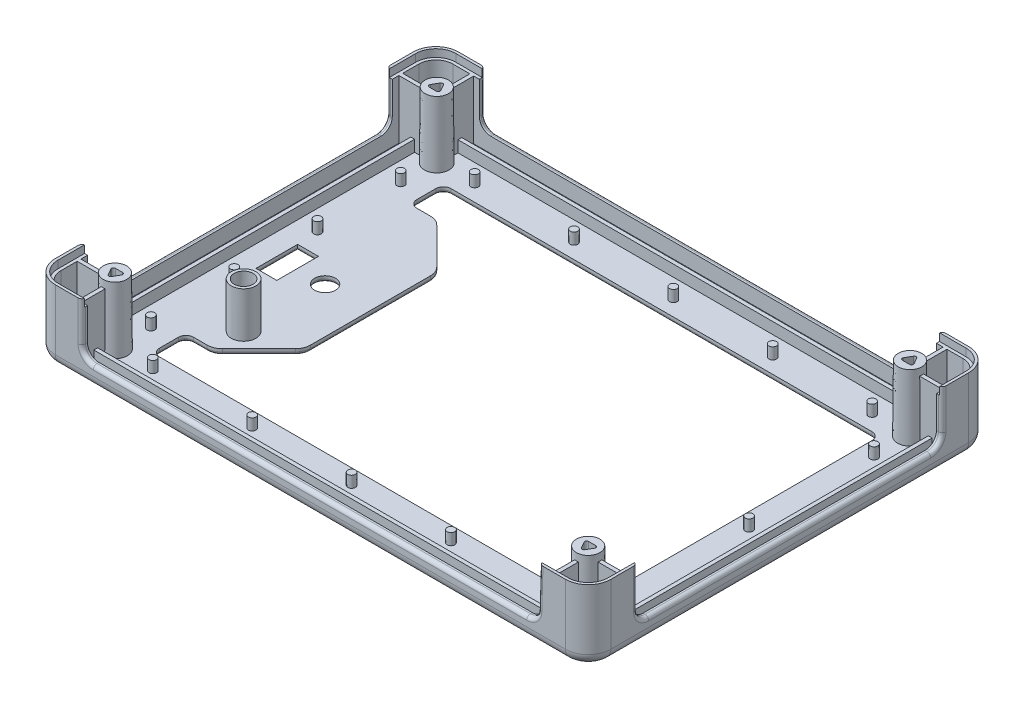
SolidWorks part; units mm, degrees
ref_plane "Plan de face" through (0, 0, 0) normal (0, 0, 1) x (1, 0, 0)
ref_plane "Plan de dessus" through (0, 0, 0) normal (0, 1, 0) x (1, 0, 0)
ref_plane "Plan de droite" through (0, 0, 0) normal (1, 0, 0) x (0, 0, -1)
sketch "Esquisse1" plane through (0, 0, 0) normal (0, 1, 0) x (1, 0, 0)
  line L0 (93.2862, 47.5) -> (62.0832, 47.5) construction
  line L1 (67.5, 66.4163) -> (67.5, 36.9349) construction
  line L2 (-21.7752, -3.5) -> (163.2239, -3.5) construction
  line L3 (0, 0) -> (135, 0) construction
  line L4 (0, 0) -> (0, 95) construction
  line L5 (0, 95) -> (135, 95) construction
  line L6 (135, 0) -> (135, 95) construction
  line L7 (-21.7752, 98.5) -> (163.2239, 98.5) construction
  line L8 (138.5, -9.5468) -> (138.5, 120.2146) construction
  line L10 (-3.75, -9.5468) -> (-3.75, 120.2146) construction
  line L12 (-21.7752, -5.75) -> (163.2239, -5.75) construction
  line L13 (140.75, -9.5468) -> (140.75, 120.2146) construction
  line L16 (-21.7752, 100.75) -> (163.2239, 100.75) construction
  line L17 (-6, -9.5468) -> (-6, 120.2146) construction
  line L19 (0, 100.75) -> (134.75, 100.75)
  line L20 (-6, 94.75) -> (-6, 0.25)
  line L21 (0, -5.75) -> (134.75, -5.75)
  line L22 (140.75, 94.75) -> (140.75, 0.25)
  circle A0 centre (5, 5) radius 1.6 construction
  circle A1 centre (130, 5) radius 1.6 construction
  circle A2 centre (5, 90) radius 1.6 construction
  circle A3 centre (130, 90) radius 1.6 construction
  arc A4 (134.75, 100.75) -> (140.75, 94.75) centre (134.75, 94.75) cw
  arc A5 (134.75, -5.75) -> (140.75, 0.25) centre (134.75, 0.25) ccw
  arc A6 (-6, 0.25) -> (0, -5.75) centre (0, 0.25) ccw
  arc A7 (0, 100.75) -> (-6, 94.75) centre (0, 94.75) ccw
  point P49 (140.75, -5.75)
  point P54 (-6, 100.75)
  dimension "D4" = 51
  dimension "D6" = 142.25
  dimension "D5" = 3.5
  dimension "D15" = 6
  dimension "D1" = 47.5
  dimension "D2" = 67.5
  dimension "D3" = 102
  dimension "D9" = 2.25
  dimension "D10" = 2.25
  dimension "D13" = 2.25
  dimension "D14" = 2.25
extrude "Boss.-Extru.1" add sketch "Esquisse1" along normal blind 19
shell "Coque1" thickness 1.5
sketch "Esquisse3" plane through (0, 1.5, 0) normal (0, 1, 0) x (1, 0, 0)
  line L1 (134.75, 100.75) -> (0, 100.75) construction
  line L2 (140.75, 0.25) -> (140.75, 94.75) construction
  line L3 (0, -5.75) -> (134.75, -5.75) construction
  line L4 (-6, 94.75) -> (-6, 0.25) construction
  circle A0 centre (130, 5) radius 3.1
  circle A1 centre (130, 90) radius 3.1
  circle A2 centre (5, 90) radius 3.1
  circle A3 centre (5, 5) radius 3.1
  dimension "D5" = 11
  dimension "D7" = 11
  dimension "D1" = 10.75
  dimension "D2" = 10.75
  dimension "D3" = 10.75
  dimension "D4" = 10.75
  dimension "D6" = 10.75
  dimension "D8" = 10.75
extrude "Boss.-Extru.2" add sketch "Esquisse3" along normal blind 17.4
sketch "Esquisse4" plane through (0, 1.5, 0) normal (0, 1, 0) x (1, 0, 0)
  line L0 (34.5143, 47.5) -> (-12.1343, 47.5) construction
  line L1 (0, 0) -> (135, 0) construction
  line L2 (0, 0) -> (0, 94.9999) construction
  line L3 (0, 94.9999) -> (135, 94.9999) construction
  line L4 (135, 0) -> (135, 94.9999) construction
  line L5 (8, 54.3821) -> (8, 20.2303) construction
  line L6 (10.75, -7.9482) -> (10.75, 103.5972) construction
  line L7 (5.25, 53) -> (10.75, 53)
  line L8 (5.25, 53) -> (5.25, 42)
  line L9 (5.25, 42) -> (10.75, 42)
  line L10 (10.75, 53) -> (10.75, 42)
  line L11 (5.25, 53) -> (10.75, 42) construction
  line L12 (5.25, 42) -> (10.75, 53) construction
  line L13 (-2.1355, 85.9999) -> (151.3531, 85.9999) construction
  line L14 (126, 105.1554) -> (126, -7.9482) construction
  line L15 (144.2111, 9) -> (-9.2775, 9) construction
  line L16 (18, 60.2881) -> (18, 12.9851) construction
  line L17 (-9.2775, 18) -> (57.4001, 18) construction
  line L18 (10.75, 11) -> (10.75, 16)
  line L19 (12.75, 9) -> (124, 9)
  line L20 (126, 11) -> (126, 83.9999)
  line L21 (12.0013, 25.98) -> (31.7418, 25.98) construction
  line L22 (30, 77) -> (30, 7.7855) construction
  line L23 (124, 85.9999) -> (12.75, 85.9999)
  line L24 (12.75, 18) -> (16.3431, 18)
  line L25 (12.75, 77) -> (16.3431, 77)
  line L26 (10.75, 83.9999) -> (10.75, 79)
  line L27 (30, 63.3431) -> (30, 31.6569)
  line L28 (18, 18) -> (32.9988, 32.9988) construction
  line L29 (19.1716, 19.1716) -> (28.8284, 28.8284)
  line L30 (19.1716, 75.8284) -> (28.8284, 66.1716)
  arc A0 (19.1716, 75.8284) -> (16.3431, 77) centre (16.3431, 73) ccw
  arc A1 (10.75, 16) -> (12.75, 18) centre (12.75, 16) cw
  arc A2 (12.75, 9) -> (10.75, 11) centre (12.75, 11) cw
  arc A3 (12.75, 77) -> (10.75, 79) centre (12.75, 79) cw
  circle A4 centre (18, 25.98) radius 2.5
  arc A5 (12.75, 85.9999) -> (10.75, 83.9999) centre (12.75, 83.9999) ccw
  arc A6 (28.8284, 66.1716) -> (30, 63.3431) centre (26, 63.3431) cw
  arc A7 (126, 83.9999) -> (124, 85.9999) centre (124, 83.9999) ccw
  arc A8 (124, 9) -> (126, 11) centre (124, 11) ccw
  circle A9 centre (18, 47.5) radius 2.75
  arc A10 (30, 31.6569) -> (28.8284, 28.8284) centre (26, 31.6569) cw
  arc A11 (19.1716, 19.1716) -> (16.3431, 18) centre (16.3431, 22) cw
  point P9 (8, 47.5)
  point P31 (30, 18)
  point P35 (126, 9)
  point P45 (10.75, 18)
  point P48 (10.75, 9)
  point P49 (126, 85.9999)
  point P53 (30, 9)
  point P54 (10.75, 77)
  point P57 (10.75, 85.9999)
  point P59 (18, 77)
  point P64 (126, 85.9999)
  point P67 (126, 9)
  point P72 (30, 65)
  point P75 (30, 30)
  dimension "D6" = 9
  dimension "D9" = 12
  dimension "D10" = 4
  dimension "D12" = 2
  dimension "D1" = 8
  dimension "D2" = 10.75
  dimension "D3" = 9
  dimension "D4" = 9
  dimension "D5" = 9
  dimension "D7" = 18
  dimension "D8" = 25.98
  dimension "D13" = 45
extrude "Enlèv. mat.-Extru.1" cut sketch "Esquisse4" against normal blind 1.5
sketch "Esquisse14" plane through (0, 19, 0) normal (0, 1, 0) x (1, 0, 0)
  line L0 (67.375, 106.4371) -> (67.375, 36.1338) construction
  line L1 (147.932, 47.5) -> (58.3023, 47.5) construction
  line L2 (134.75, 100.75) -> (0, 100.75) construction
  line L3 (140.75, 0.25) -> (140.75, 94.75) construction
  line L5 (0, 100.05) -> (134.75, 100.05)
  line L6 (-5.3, 94.75) -> (-5.3, 0.25)
  line L7 (0, -5.05) -> (134.75, -5.05)
  line L8 (140.05, 94.75) -> (140.05, 0.25)
  line L9 (-5.3, 100.05) -> (140.05, -5.05) construction
  line L10 (-5.3, -5.05) -> (140.05, 100.05) construction
  line L11 (0, 99.25) -> (134.75, 99.25)
  line L12 (-4.5, 94.75) -> (-4.5, 0.25)
  line L13 (0, -4.25) -> (134.75, -4.25)
  line L14 (139.25, 94.75) -> (139.25, 0.25)
  line L15 (-4.5, 99.25) -> (139.25, -4.25) construction
  line L16 (-4.5, -4.25) -> (139.25, 99.25) construction
  arc A0 (134.75, -4.25) -> (139.25, 0.25) centre (134.75, 0.25) ccw
  arc A1 (134.75, 99.25) -> (139.25, 94.75) centre (134.75, 94.75) cw
  arc A2 (0, 99.25) -> (-4.5, 94.75) centre (0, 94.75) ccw
  arc A3 (-4.5, 0.25) -> (0, -4.25) centre (0, 0.25) ccw
  arc A4 (-5.3, 0.25) -> (0, -5.05) centre (0, 0.25) ccw
  arc A5 (0, 100.05) -> (-5.3, 94.75) centre (0, 94.75) ccw
  arc A6 (134.75, 100.05) -> (140.05, 94.75) centre (134.75, 94.75) cw
  arc A7 (134.75, -5.05) -> (140.05, 0.25) centre (134.75, 0.25) ccw
  point P8 (67.375, 47.5)
  point P13 (67.375, 47.5)
  dimension "D3" = 4.5
  dimension "D4" = 5.3
  dimension "D1" = 53.25
  dimension "D2" = 73.375
extrude "Enlèv. mat.-Extru.8" cut sketch "Esquisse14" against normal blind 2
sketch "Esquisse5" plane through (0, 0, -100.75) normal (0, 0, -1) x (-1, 0, 0)
  line L0 (-147.5972, 0) -> (13.2402, 0) construction
  line L1 (6, 22.8326) -> (6, -23.2026) construction
  line L2 (-7, 22.8326) -> (-7, -23.2026) construction
  line L3 (13.2402, 5.5) -> (-147.5972, 5.5) construction
  line L4 (-140.75, 24.3004) -> (-140.75, -23.2026) construction
  line L6 (-147.5972, 19) -> (13.2402, 19) construction
  line L7 (-7, 19) -> (-7, 8.5)
  line L8 (-10, 5.5) -> (-124.75, 5.5)
  line L9 (-134.75, 19) -> (-134.75, 0) construction
  line L10 (-127.75, 24.3004) -> (-127.75, -23.2026) construction
  line L11 (-127.75, 8.5) -> (-127.75, 19)
  line L12 (-127.75, 19) -> (-7, 19)
  arc A0 (-124.75, 5.5) -> (-127.75, 8.5) centre (-124.75, 8.5) cw
  arc A1 (-7, 8.5) -> (-10, 5.5) centre (-10, 8.5) cw
  point P26 (-134.75, 5.5)
  point P29 (-7, 5.5)
  point P32 (-127.75, 5.5)
  dimension "D3" = 13
  dimension "D4" = 3
  dimension "D1" = 13
  dimension "D2" = 5.5
extrude "Enlèv. mat.-Extru.3" cut sketch "Esquisse5" against normal blind 1.5
sketch "Esquisse6" plane through (0, 0, 5.75) normal (0, 0, 1) x (1, 0, 0)
  line L0 (140.75, -10.7826) -> (140.75, 26.2595) construction
  line L1 (127.75, -10.7826) -> (127.75, 26.2595) construction
  line L2 (-6, -10.7826) -> (-6, 26.2595) construction
  line L3 (7, -10.7826) -> (7, 26.2595) construction
  line L4 (-12.8701, 0) -> (143.4602, 0) construction
  line L5 (-12.8701, 5.5) -> (143.4602, 5.5) construction
  line L6 (-12.8701, 19) -> (143.4602, 19) construction
  line L7 (7, 20.6084) -> (127.8535, 20.6084)
  line L8 (127.8535, 20.6084) -> (127.4987, 8.4128)
  line L9 (124.5, 5.5) -> (10, 5.5)
  line L10 (7, 8.5) -> (7, 20.6084)
  arc A0 (10, 5.5) -> (7, 8.5) centre (10, 8.5) cw
  arc A1 (127.4987, 8.4128) -> (124.5, 5.5) centre (124.5, 8.5) cw
  point P26 (7, 5.5)
  dimension "D4" = 3
  dimension "D1" = 13
  dimension "D2" = 13
  dimension "D3" = 5.5
extrude "Enlèv. mat.-Extru.4" cut sketch "Esquisse6" against normal blind 1.5
sketch "Esquisse7" plane through (140.75, 0, 0) normal (1, 0, 0) x (0, 0, -1)
  line L0 (-11.8765, 0) -> (104.6007, 0) construction
  line L1 (104.6007, 19) -> (-11.8765, 19) construction
  line L2 (-11.8765, 5.5) -> (104.6007, 5.5) construction
  line L3 (100.75, 19.5253) -> (100.75, -15.4385) construction
  line L4 (87.75, 19.5253) -> (87.75, -15.4385) construction
  line L5 (7.25, 19.5253) -> (7.25, -15.4385) construction
  line L6 (-5.75, 19.5253) -> (-5.75, -15.4385) construction
  line L7 (87.75, 19) -> (87.75, 8.5)
  line L8 (84.75, 5.5) -> (10.25, 5.5)
  line L9 (7.25, 8.5) -> (7.25, 19)
  line L10 (7.25, 19) -> (87.75, 19)
  arc A0 (87.75, 8.5) -> (84.75, 5.5) centre (84.75, 8.5) cw
  arc A1 (10.25, 5.5) -> (7.25, 8.5) centre (10.25, 8.5) cw
  point P23 (87.75, 5.5)
  point P26 (7.25, 5.5)
  dimension "D4" = 3
  dimension "D1" = 13
  dimension "D2" = 5.5
  dimension "D3" = 13
extrude "Enlèv. mat.-Extru.5" cut sketch "Esquisse7" against normal blind 1.5
sketch "Esquisse8" plane through (-6, 0, 0) normal (-1, 0, 0) x (0, 0, 1)
  line L0 (-103.3594, 0) -> (19.9451, 0) construction
  line L1 (-100.75, 18.4909) -> (-100.75, -26.8173) construction
  line L2 (-87.75, 18.4909) -> (-87.75, -26.8173) construction
  line L3 (-7.25, 18.4909) -> (-7.25, -26.8173) construction
  line L4 (5.75, 18.4909) -> (5.75, -26.8173) construction
  line L5 (-103.3594, 19) -> (19.9451, 19) construction
  line L6 (-103.3594, 5.5) -> (19.9451, 5.5) construction
  line L7 (-7.25, 19.7884) -> (-7.25, 8.5)
  line L8 (-10.25, 5.5) -> (-84.75, 5.5)
  line L9 (-87.75, 8.5) -> (-87.75, 19.7884)
  line L10 (-87.75, 19.7884) -> (-7.25, 19.7884)
  arc A0 (-7.25, 8.5) -> (-10.25, 5.5) centre (-10.25, 8.5) cw
  arc A1 (-84.75, 5.5) -> (-87.75, 8.5) centre (-84.75, 8.5) cw
  point P29 (-87.75, 5.5)
  dimension "D4" = 3
  dimension "D1" = 13
  dimension "D2" = 13
  dimension "D3" = 5.5
extrude "Enlèv. mat.-Extru.6" cut sketch "Esquisse8" against normal blind 1.5
fillet "Congé2" radius 3 8 edges at (138.9926, 0, -98.9926) (140.75, 0, -47.5) (138.9926, 0, 3.9926) (67.375, 0, 5.75) (-4.2426, 0, 3.9926) (-6, 0, -47.5) (-4.2426, 0, -98.9926) (67.375, 0, -100.75)
draft "Dépouille1" type of draft neutral plane draft angle 0.5 faces to draft 4 parameters "D1"=0.5
sketch "Esquisse9" plane through (0, 18.9, 0) normal (0, 1, 0) x (1, 0, 0)
  line L0 (5, 88.0034) -> (5, 92.0559) construction
  line L1 (67.5, 105.3416) -> (67.5, 38.7839) construction
  line L2 (-10.9964, 47.5) -> (72.5147, 47.5) construction
  line L3 (131.3856, 89.7) -> (130.433, 91.35)
  line L4 (129.567, 91.35) -> (128.6144, 89.7)
  line L5 (5.433, 91.35) -> (6.3856, 89.7)
  line L6 (130.9526, 88.95) -> (129.0474, 88.95)
  line L7 (4.0474, 88.95) -> (5.9526, 88.95)
  line L8 (3.6144, 89.7) -> (4.567, 91.35)
  line L9 (131.3856, 5.3) -> (130.433, 3.65)
  line L10 (129.567, 3.65) -> (128.6144, 5.3)
  line L11 (130.9526, 6.05) -> (129.0474, 6.05)
  line L12 (3.6144, 5.3) -> (4.567, 3.65)
  line L13 (5.433, 3.65) -> (6.3856, 5.3)
  line L14 (4.0474, 6.05) -> (5.9526, 6.05)
  circle A0 centre (5, 90) radius 1.6 construction
  arc A1 (5.433, 91.35) -> (4.567, 91.35) centre (5, 91.1) ccw
  arc A2 (5.9526, 88.95) -> (6.3856, 89.7) centre (5.9526, 89.45) ccw
  arc A3 (3.6144, 89.7) -> (4.0474, 88.95) centre (4.0474, 89.45) ccw
  circle A6 centre (130, 90) radius 3.1 construction
  arc A7 (131.3856, 89.7) -> (130.9526, 88.95) centre (130.9526, 89.45) cw
  arc A8 (129.567, 91.35) -> (130.433, 91.35) centre (130, 91.1) cw
  arc A9 (129.0474, 88.95) -> (128.6144, 89.7) centre (129.0474, 89.45) cw
  arc A10 (129.567, 3.65) -> (130.433, 3.65) centre (130, 3.9) ccw
  arc A11 (129.0474, 6.05) -> (128.6144, 5.3) centre (129.0474, 5.55) ccw
  arc A12 (131.3856, 5.3) -> (130.9526, 6.05) centre (130.9526, 5.55) ccw
  arc A13 (3.6144, 5.3) -> (4.0474, 6.05) centre (4.0474, 5.55) cw
  arc A14 (5.433, 3.65) -> (4.567, 3.65) centre (5, 3.9) cw
  arc A15 (5.9526, 6.05) -> (6.3856, 5.3) centre (5.9526, 5.55) cw
  dimension "D1" = 3
  dimension "D2" = 62.5
extrude "Enlèv. mat.-Extru.7" cut sketch "Esquisse9" against normal blind 17.4
sketch "Esquisse12" plane through (0, 1.5, 0) normal (0, 1, 0) x (1, 0, 0)
  line L0 (67.5, 113.985) -> (67.5, 34.9751) construction
  line L1 (155.7783, 47.5) -> (60.1347, 47.5) construction
  line L2 (-11.6058, 99.25) -> (8.0611, 99.25) construction
  line L3 (134.75, 99.25) -> (0, 99.25) construction
  line L4 (-12.3044, 90) -> (11.4464, 90) construction
  line L5 (5, 83.8057) -> (5, 104.5473) construction
  line L6 (11.4464, 92.9381) -> (4.0112, 92.9381) construction
  line L7 (2.067, 90) -> (2.067, 95.1593) construction
  line L8 (5.5, 103.5754) -> (5.5, 92.9381) construction
  line L9 (-9.4022, 90.5) -> (2.067, 90.5) construction
  line L10 (5.5, 99.25) -> (5.5, 92.9381)
  line L11 (2.067, 90.5) -> (-4.5344, 90.5)
  line L12 (4.5, 99.25) -> (4.5, 92.9381)
  line L13 (2.067, 89.5) -> (-4.5344, 89.5)
  line L14 (5.5, 92.9381) -> (4.5, 92.9381)
  line L15 (5.5, 99.25) -> (4.5, 99.25)
  line L16 (2.067, 90.5) -> (2.067, 89.5)
  line L17 (-4.5344, 90.5) -> (-4.5344, 89.5)
  line L18 (129.5, 99.25) -> (130.5, 99.25)
  line L19 (130.5, 99.25) -> (130.5, 92.9381)
  line L20 (129.5, 99.25) -> (129.5, 92.9381)
  line L21 (129.5, 92.9381) -> (130.5, 92.9381)
  line L22 (132.933, 90.5) -> (132.933, 89.5)
  line L23 (132.933, 90.5) -> (139.5344, 90.5)
  line L24 (132.933, 89.5) -> (139.5344, 89.5)
  line L25 (139.5344, 90.5) -> (139.5344, 89.5)
  line L26 (139.5344, 4.5) -> (139.5344, 5.5)
  line L27 (132.933, 5.5) -> (139.5344, 5.5)
  line L28 (132.933, 4.5) -> (139.5344, 4.5)
  line L29 (132.933, 4.5) -> (132.933, 5.5)
  line L30 (129.5, 2.0619) -> (130.5, 2.0619)
  line L31 (129.5, -4.25) -> (129.5, 2.0619)
  line L32 (129.5, -4.25) -> (130.5, -4.25)
  line L33 (130.5, -4.25) -> (130.5, 2.0619)
  line L34 (-4.5344, 4.5) -> (-4.5344, 5.5)
  line L35 (2.067, 5.5) -> (-4.5344, 5.5)
  line L36 (2.067, 4.5) -> (-4.5344, 4.5)
  line L37 (2.067, 4.5) -> (2.067, 5.5)
  line L38 (4.5, -4.25) -> (4.5, 2.0619)
  line L39 (5.5, 2.0619) -> (4.5, 2.0619)
  line L40 (5.5, -4.25) -> (5.5, 2.0619)
  line L41 (5.5, -4.25) -> (4.5, -4.25)
  circle A0 centre (130, 90) radius 3.1 construction
  circle A1 centre (5, 90) radius 3.1 construction
  dimension "D1" = 62.5
  dimension "D2" = 42.5
  dimension "D3" = 0.5
  dimension "D4" = 0.5
fillet "Congé3" radius 0.75 26 edges at (8, 0, -42) (5.25, 0, -47.5) (8, 0, -53) (10.75, 0, -47.5) (18, 0, -23.48) (68.375, 0, -85.9999) (126, 0, -47.4999) (68.375, 0, -9) (18, 0, -44.75) (14.5466, 0, -77) (11.3358, 0, -77.5858) (10.75, 0, -81.4999) (11.3358, 0, -85.4141) (125.4142, 0, -85.4141) (125.4142, 0, -9.5858) (11.3358, 0, -9.5858) (10.75, 0, -13.5) (11.3358, 0, -17.4142) (14.5466, 0, -18) (30, 0, -47.5) (29.6955, 0, -64.8739) (24, 0, -71) (17.8739, 0, -76.6955) (17.8739, 0, -18.3045) (24, 0, -24) (29.6955, 0, -30.1261)
sketch "Esquisse10" plane through (0, 0, 0) normal (0, -1, 0) x (1, 0, 0)
  line L0 (143.5815, -70.25) -> (110.1511, -70.25) construction
  line L1 (14.1918, -31.3165) -> (14.1918, -19.3718) construction
  line L2 (134.75, -100.75) -> (0, -100.75) construction
  line L3 (143.5815, -55) -> (110.1511, -55) construction
  line L4 (143.5815, -39.75) -> (110.1511, -39.75) construction
  line L5 (143.5815, -24.5) -> (110.1511, -24.5) construction
  line L6 (130.75, -71.1701) -> (130.75, -23.5701) construction
  line L7 (121.3111, 1.75) -> (13.7249, 1.75) construction
  line L8 (15, 13.4191) -> (15, -107.8345) construction
  line L9 (30, 13.4191) -> (30, -107.8345) construction
  line L10 (45, 13.4191) -> (45, -107.8345) construction
  line L11 (60, 13.4191) -> (60, -107.8345) construction
  line L12 (75, 13.4191) -> (75, -107.8345) construction
  line L13 (90, 13.4191) -> (90, -107.8345) construction
  line L14 (105, 13.4191) -> (105, -107.8345) construction
  line L15 (120, 13.4191) -> (120, -107.8345) construction
  line L16 (0, 13.4191) -> (0, -107.8345) construction
  line L17 (121.3111, -93.15) -> (13.3856, -93.15) construction
  line L18 (134.75, 2.75) -> (0, 2.75) construction
  line L19 (120.9806, -4.25) -> (15, -4.25) construction
  line L20 (120.9806, -89.3499) -> (13.9238, -89.3499) construction
  line L21 (27.5809, -76.25) -> (27.5809, -18.75) construction
  line L22 (0, -97.75) -> (134.75, -97.75) construction
  line L23 (16.3431, -18.75) -> (12.75, -18.75) construction
  line L24 (12.75, -76.25) -> (16.3431, -76.25) construction
  line L25 (136.75, -71.6256) -> (136.75, -23.1936) construction
  line L26 (137.75, -94.75) -> (137.75, -0.25) construction
  line L30 (3.7841, -55.6482) -> (3.7841, -39.4039) construction
  line L31 (12.75, -8.25) -> (124, -8.25) construction
  line L32 (126.75, -11) -> (126.75, -83.9999) construction
  line L33 (124, -86.7499) -> (12.75, -86.7499) construction
  line L35 (-13.7117, -47.5) -> (7.3762, -47.5) construction
  line L36 (-13.7117, -75.5) -> (2.3409, -75.5) construction
  line L37 (-13.7117, -19.5) -> (2.3409, -19.5) construction
  line L38 (1, -88.5) -> (1, -62.5) construction
  line L39 (-3, -0.25) -> (-3, -94.75) construction
  line L40 (1, -32.5) -> (1, -6.5) construction
  text T0 "12 VDC" font "Arial" height in points 11
  text T1 "OFF / ON</r>" font "Arial" height in points 10
  text T2 "0 1 2 3</r>" font "Arial" height in points 14
  text T3 "AutoProg" font "Arial" height in points 18
  text T5 "PROG." font "Arial" height in points 11
  text T6 "Reset" font "Arial" height in points 10
  text T7 "ENTREES ANALOGIQUES" font "Arial" height in points 10
  text T8 "0 1 2 3 4 5 6 7</r>" font "Arial" height in points 14
  text T9 "ENTREES NUMERIQUES" font "Arial" height in points 10
  text T10 "SORTIES NUMERIQUES" font "Arial" height in points 10
  text T12 "0 1 2 3 4 5 6 7</r>" font "Arial" height in points 14
  dimension "D1" = 30.5
  dimension "D4" = 1
  dimension "D5" = 4
  dimension "D6" = 4.6
  dimension "D7" = 4
  dimension "D8" = 2.6
  dimension "D9" = 1
  dimension "D10" = 4
  dimension "D12" = 28
  dimension "D13" = 13
  dimension "D14" = 4
  dimension "D15" = 13
  dimension "D2" = 4
  dimension "D3" = 9
sketch "Esquisse11" plane through (0, 1.5, 0) normal (0, 1, 0) x (1, 0, 0)
  line L0 (-1.8984, 5) -> (148.1379, 5) construction
  line L1 (-13.6379, 58.5) -> (7.6355, 58.5) construction
  line L2 (0, 10) -> (0, 85) construction
  line L3 (135, 10) -> (135, 85) construction
  line L4 (10, 0) -> (125, 0) construction
  line L5 (130, -2.4216) -> (130, 105.9111) construction
  line L6 (148.1379, 90) -> (-10.0588, 90) construction
  line L7 (5, -9.7658) -> (5, 105.9111) construction
  line L8 (148.1379, 47.5) -> (-13.6379, 47.5) construction
  line L9 (67.5, 104.1783) -> (67.5, 37.6217) construction
  line L10 (130, 85) -> (135, 85) construction
  line L11 (125, 90) -> (125, 95) construction
  line L12 (5, 85) -> (0, 85) construction
  line L13 (10, 90) -> (10, 95) construction
  line L14 (125, 5) -> (125, 0) construction
  line L15 (130, 10) -> (135, 10) construction
  line L16 (10, 5) -> (10, 0) construction
  line L17 (5, 10) -> (0, 10) construction
  line L18 (10, 95) -> (125, 95) construction
  line L19 (41.25, 104.1783) -> (41.25, 82.2206) construction
  circle A0 centre (41.25, 90) radius 1
  circle A1 centre (67.5, 90) radius 1
  circle A2 centre (130, 47.5) radius 1
  arc A3 (10, 90) -> (5, 85) centre (5, 90) cw construction
  arc A4 (125, 90) -> (130, 85) centre (130, 90) ccw construction
  arc A5 (125, 5) -> (130, 10) centre (130, 5) cw construction
  arc A6 (10, 5) -> (5, 10) centre (5, 5) ccw construction
  circle A7 centre (93.75, 90) radius 1
  circle A8 centre (120, 90) radius 1
  circle A9 centre (15, 5) radius 1
  circle A10 centre (120, 5) radius 1
  circle A11 centre (93.75, 5) radius 1
  circle A12 centre (67.5, 5) radius 1
  circle A13 centre (41.25, 5) radius 1
  circle A14 centre (5, 80.5) radius 1
  circle A15 centre (5, 58.5) radius 1
  circle A16 centre (5, 36.5) radius 1
  circle A17 centre (5, 14.5) radius 1
  circle A18 centre (130, 14.5) radius 1
  circle A21 centre (130, 80.5) radius 1
  circle A24 centre (15, 90) radius 1
  dimension "D3" = 2
  dimension "D1" = 62.5
  dimension "D4" = 11
  dimension "D5" = 26.25
extrude "Boss.-Extru.3" add sketch "Esquisse11" along normal blind 3
extrude "Boss.-Extru.4" add sketch "Esquisse12" along normal blind 15.5
sketch "Esquisse13" plane through (0, 1.5, 0) normal (0, 1, 0) x (1, 0, 0)
  line L0 (149.948, 47.5) -> (58.958, 47.5) construction
  line L1 (67.5, 108.9312) -> (67.5, 41.1581) construction
  line L2 (-24.1887, -1.1) -> (159.7798, -1.1) construction
  line L3 (159.7798, -0.1) -> (-25.8915, -0.1) construction
  line L4 (-1.35, -20.4921) -> (-1.35, 108.9312) construction
  line L5 (-0.35, 108.9312) -> (-0.35, -20.4921) construction
  line L6 (5.5, -4.25) -> (129.5, -4.25) construction
  line L7 (-4.5, 89.5) -> (-4.5, 5.5) construction
  line L8 (2.7278, 5.5) -> (-10.4051, 5.5) construction
  line L9 (5.5, 2.8916) -> (5.5, -9.2771) construction
  line L10 (129.5, -11.6753) -> (129.5, 2.5575) construction
  line L11 (-11.1635, 89.5) -> (2.7278, 89.5) construction
  line L12 (5.5, 96.1) -> (129.5, 96.1)
  line L13 (-0.35, 89.5) -> (-1.35, 89.5)
  line L14 (-0.35, 89.5) -> (-0.35, 5.5)
  line L15 (-0.35, 5.5) -> (-1.35, 5.5)
  line L16 (-1.35, 89.5) -> (-1.35, 5.5)
  line L17 (5.5, -0.1) -> (129.5, -0.1)
  line L18 (5.5, -0.1) -> (5.5, -1.1)
  line L19 (5.5, -1.1) -> (129.5, -1.1)
  line L20 (129.5, -0.1) -> (129.5, -1.1)
  line L21 (129.5, 95.1) -> (129.5, 96.1)
  line L22 (5.5, 95.1) -> (129.5, 95.1)
  line L23 (5.5, 95.1) -> (5.5, 96.1)
  line L24 (135.35, 5.5) -> (136.35, 5.5)
  line L25 (136.35, 89.5) -> (136.35, 5.5)
  line L26 (135.35, 89.5) -> (135.35, 5.5)
  line L27 (135.35, 89.5) -> (136.35, 89.5)
  circle A0 centre (130, 90) radius 3.1 construction
  dimension "D1" = 62.5
  dimension "D2" = 42.5
  dimension "D3" = 1
  dimension "D4" = 1
  dimension "D5" = 3.15
  dimension "D6" = 3.15
extrude "Boss.-Extru.5" add sketch "Esquisse13" along normal blind 3
extrude "Boss.-Extru.6" add sketch "Esquisse10" along normal blind 0.4
fillet "Congé4" radius 1 20 edges at (-6, 13.75, -87.75) (-6, 6.3787, -86.8713) (-6, 5.5, -47.5) (-6, 6.3787, -8.1287) (127.6527, 13.7064, 5.75) (126.5902, 6.3481, 5.75) (67.25, 5.5, 5.75) (7.8787, 6.3787, 5.75) (140.75, 13.75, -7.25) (140.75, 6.3787, -8.1287) (140.75, 5.5, -47.5) (140.75, 6.3787, -86.8713) (127.75, 13.75, -100.75) (126.8713, 6.3787, -100.75) (67.375, 5.5, -100.75) (7.8787, 6.3787, -100.75) (-6, 13.75, -7.25) (7, 13.75, 5.75) (140.75, 13.75, -87.75) (7, 13.75, -100.75)
sketch "Esquisse15" plane through (0, 1.5, 0) normal (0, 1, 0) x (1, 0, 0)
  circle A2 centre (18, 25.98) radius 2.5
  circle A3 centre (18, 25.98) radius 3.25
extrude "Boss.-Extru.7" add sketch "Esquisse15" along normal blind 12
